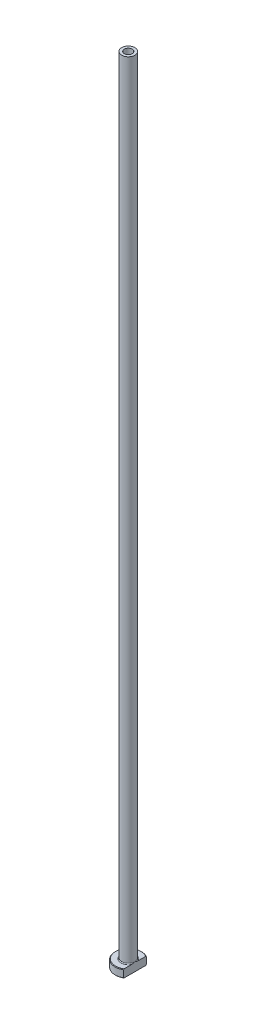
SolidWorks part; units mm, degrees
ref_plane "Front Plane" through (0, 0, 0) normal (0, 0, 1) x (1, 0, 0)
ref_plane "Top Plane" through (0, 0, 0) normal (0, 1, 0) x (1, 0, 0)
ref_plane "Right Plane" through (0, 0, 0) normal (1, 0, 0) x (0, 0, -1)
sketch "Sketch1" plane through (0, 0, 0) normal (0, 0, 1) x (1, 0, 0)
  line L0 (-1.5, 300) -> (-2.5, 300)
  line L1 (-2.5, 300) -> (-2.5, 3)
  line L2 (-2.5, 3) -> (-5, 3)
  line L3 (-5, 3) -> (-5, 0)
  line L4 (4.125, 0) -> (-4.125, 0) construction
  line L5 (-5, 0) -> (-1.75, 0)
  line L6 (-1.5, 255) -> (-1.5, 300)
  line L7 (0, 92.1877) -> (0, -15.5353) construction
  line L8 (0, -5.5) -> (0, 5.5) construction
  line L9 (-1.5, 255) -> (-1.75, 243)
  line L10 (-1.75, 243) -> (-1.75, 0)
  dimension "D1" = 0.25
  dimension "ID" = 3
  dimension "OD" = 5
  dimension "L" = 300
  dimension "H" = 10
  dimension "T" = 3
  dimension "N" = 45
  dimension "D2" = 12
  dimension "L-N" = 255
revolve "Revolve1" add sketch "Sketch1" angle 360 about L7
fillet "Fillet1" radius 0.3 1 edges at (0, 3, 2.5)
chamfer "Chamfer1" distance 0.2 angle 45 2 edges at (0, 3, 5) (0, 0, 5)
sketch "Sketch2" plane through (0, 0, 0) normal (0, -1, 0) x (1, 0, 0)
  line L0 (2.5, 4.3301) -> (2.5, -4.3301)
  circle A0 centre (0, 0) radius 5 construction
  arc A1 (2.5, 4.3301) -> (2.5, -4.3301) centre (0, 0) cw
  circle A2 centre (0, 0) radius 2.5 construction
extrude "Cut-Extrude1" cut sketch "Sketch2" against normal through all
chamfer "Chamfer2" distance 0.5 angle 45 1 edges at (0, 0, 1.75)
